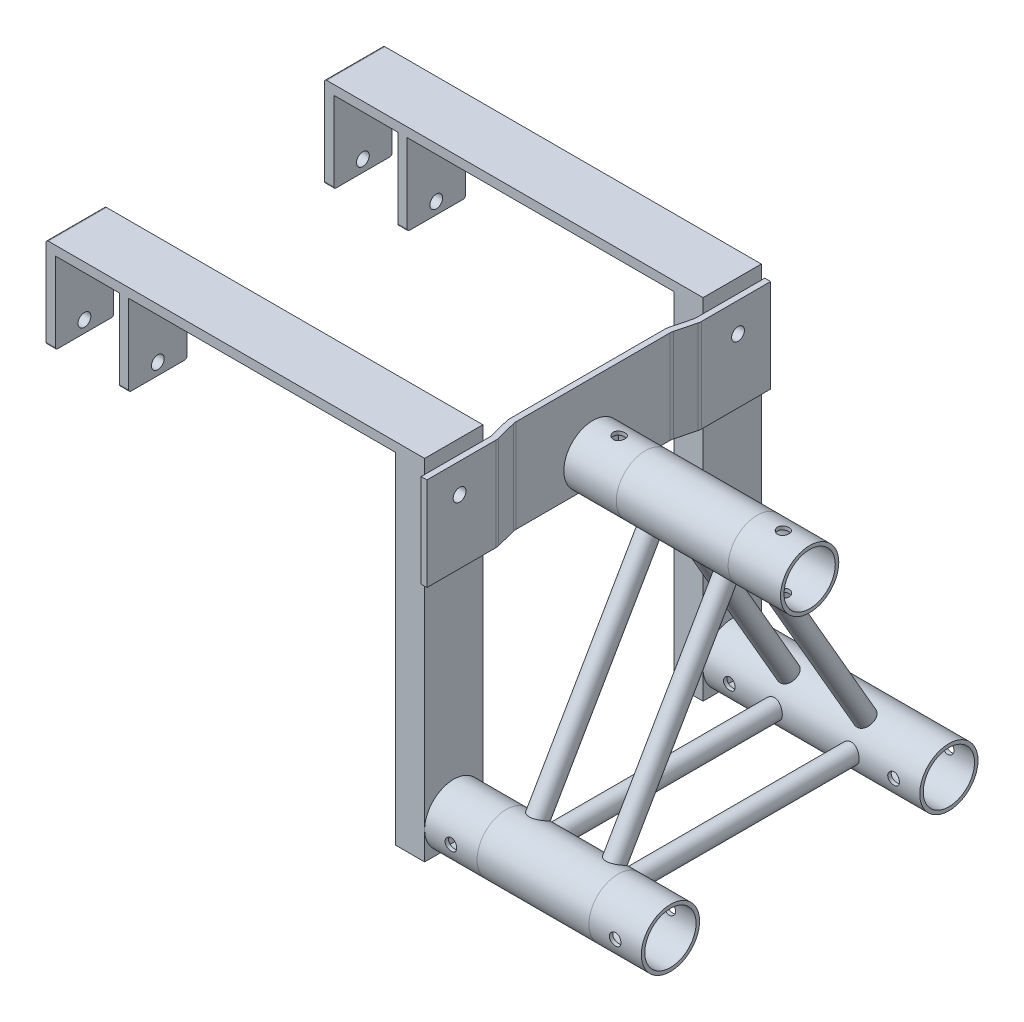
SolidWorks part; units mm, degrees
ref_plane "Face" through (0, 0, 0) normal (0, 0, 1) x (1, 0, 0)
ref_plane "Dessus" through (0, 0, 0) normal (0, 1, 0) x (1, 0, 0)
ref_plane "Droite" through (0, 0, 0) normal (1, 0, 0) x (0, 0, -1)
sketch "Esquisse1" plane through (0, 0, 0) normal (0, 0, 1) x (1, 0, 0)
  line L0 (0, 0) -> (0, 78)
  line L1 (0, 78) -> (325, 78)
  line L2 (325, 78) -> (325, 70)
  line L3 (325, 70) -> (71, 70)
  line L4 (71, 70) -> (71, 0)
  line L5 (71, 0) -> (63, 0)
  line L6 (63, 0) -> (63, 70)
  line L7 (63, 70) -> (8, 70)
  line L8 (8, 70) -> (8, 0)
  line L9 (8, 0) -> (0, 0)
  dimension "D1" = 325
  dimension "D2" = 254
  dimension "D3" = 8
  dimension "D4" = 8
  dimension "D5" = 78
  dimension "D6" = 8
extrude "Extrusion1" add sketch "Esquisse1" along normal blind 50
sketch "Esquisse2" plane through (0, 70, 0) normal (0, -1, 0) x (1, 0, 0)
  line L0 (300, 50) -> (325, 50)
  line L1 (71, 50) -> (325, 50) construction
  line L2 (325, 50) -> (325, 0)
  line L3 (325, 0) -> (300, 0)
  line L4 (71, 0) -> (325, 0) construction
  line L5 (300, 0) -> (300, 5)
  line L6 (300, 5) -> (320, 5)
  line L7 (320, 5) -> (320, 45)
  line L8 (320, 45) -> (300, 45)
  line L9 (300, 45) -> (300, 50)
  dimension "D1" = 25
  dimension "D2" = 5
  dimension "D3" = 5
extrude "Extrusion2" add sketch "Esquisse2" along normal blind 292
sketch "Esquisse3" plane through (325, 0, 0) normal (1, 0, 0) x (0, 0, -1)
  line L0 (0, -222) -> (0, 78) construction
  line L1 (0, -222) -> (-50, -222) construction
  circle A0 centre (-25, 41) radius 5.5
  circle A1 centre (-25, -198) radius 5.5
  dimension "D1" = 11
  dimension "D2" = 25
  dimension "D3" = 239
  dimension "D4" = 24
extrude "Enlèv. mat.-Extru.1" cut sketch "Esquisse3" against normal up to next
sketch "Esquisse4" plane through (71, 0, 0) normal (1, 0, 0) x (0, 0, -1)
  line L0 (0, -222) -> (0, 78) construction
  line L1 (-50, 0) -> (0, 0) construction
  circle A0 centre (-25, 10) radius 5.5
  dimension "D2" = 11
  dimension "D1" = 25
  dimension "D3" = 10
extrude "Enlèv. mat.-Extru.2" cut sketch "Esquisse4" against normal through all
fillet "Congé1" radius 2
pattern_linear "Répétition linéaire1" count 2 spacing 239
ref_plane "Plan1" through (0, 66, 0) normal (0, 1, 0) x (-1, 0, 0)
sketch "Esquisse5" plane through (0, 66, 0) normal (0, 1, 0) x (-1, 0, 0)
  line L0 (-325, 292) -> (-330, 292)
  line L1 (-330, 292) -> (-330, 231.3649)
  line L2 (-330, 231.3649) -> (-325, 212)
  line L3 (-325, 212) -> (-325, 77)
  line L4 (-325, 77) -> (-330, 57.6351)
  line L5 (-330, 57.6351) -> (-330, -3)
  line L6 (-330, -3) -> (-325, -3)
  line L7 (-325, -3) -> (-325, 57)
  line L8 (-325, 57) -> (-320, 76.3649)
  line L9 (-320, 76.3649) -> (-320, 212.6351)
  line L10 (-320, 212.6351) -> (-325, 232)
  line L11 (-325, 232) -> (-325, 292)
  line L12 (-325, 289) -> (-325, 239) construction
  line L14 (-325, 289) -> (-2, 289) construction
  dimension "D1" = 5
  dimension "D2" = 5
  dimension "D3" = 3
  dimension "D4" = 295
  dimension "D5" = 135
  dimension "D6" = 175
  dimension "D7" = 60
  dimension "D8" = 80
  dimension "D9" = 20
  dimension "D10" = 20
extrude "Extrusion3" add sketch "Esquisse5" against normal blind 80
sketch "Esquisse6" plane through (330, 0, 0) normal (1, 0, 0) x (0, 0, -1)
  circle A0 centre (-264, 41) radius 5.5 construction
  circle A1 centre (-25, 41) radius 5.5 construction
  circle A2 centre (-264, 41) radius 5.5
  circle A3 centre (-25, 41) radius 5.5
extrude "Enlèv. mat.-Extru.3" cut sketch "Esquisse6" against normal blind 5
sketch "Esquisse7" plane through (325, 0, 0) normal (1, 0, 0) x (0, 0, -1)
  line L0 (3, -14) -> (3, 66) construction
  circle A0 centre (-144.5, 9) radius 5.5
  circle A1 centre (-25, 41) radius 5.5 construction
  dimension "D2" = 147.5
  dimension "D1" = 32
extrude "Enlèv. mat.-Extru.4" cut sketch "Esquisse7" against normal blind 5
sketch "Esquisse8" plane through (325, 0, 0) normal (1, 0, 0) x (0, 0, -1)
  circle A0 centre (-144.5, 9) radius 25
  circle A1 centre (-25, -198) radius 25
  circle A2 centre (-264, -198) radius 25
  circle A3 centre (-144.5, 9) radius 5.5 construction
  circle A4 centre (-264, -198) radius 5.5 construction
  circle A5 centre (-25, -198) radius 5.5 construction
  dimension "D1" = 50
extrude "Extru.-Mince3" add sketch "Esquisse8" along normal blind 186 thin
sketch "Esquisse9" plane through (0, 0, 0) normal (0, 0, 1) x (1, 0, 0)
  line L0 (370, 91.5662) -> (370, -251.9659)
  line L1 (370, -251.9659) -> (466, -251.9659)
  line L2 (466, -251.9659) -> (466, 91.5662)
  line L3 (466, 91.5662) -> (370, 91.5662)
  line L4 (325, -198) -> (325, -14) construction
  line L5 (511, -16) -> (511, 34) construction
  dimension "D1" = 45
  dimension "D2" = 45
ref_plane "Plan2" through (0, 64.8203, 112.2721) normal (0, -0.5, -0.866) x (-1, 0, 0)
ref_plane "Plan4" through (385, 0, 0) normal (1, 0, 0) x (0, 0, -1)
sketch "Esquisse12" plane through (385, 0, 0) normal (1, 0, 0) x (0, 0, -1)
  line L0 (-144.5, 9) -> (-25, -198)
  line L1 (-177.224, -47.6797) -> (-47.3202, 177.3203) construction
  line L2 (-25, -198) -> (-264, -198)
  line L3 (-264, -198) -> (-144.5, 9)
ref_plane "Plan5" through (385, 9, 144.5) normal (0, -0.866, -0.5) x (1, 0, 0)
sketch "Esquisse13" plane through (385, 9, 144.5) normal (0, -0.866, -0.5) x (1, 0, 0)
  circle A0 centre (0, 0) radius 8
  dimension "D1" = 16
sweep "Balayage-Mince2" add profiles "Esquisse13" path "Esquisse12" parameters "D1"=2
pattern_linear "Répétition linéaire2" count 2 spacing 66
sketch "Esquisse14" plane through (0, 0, 289) normal (0, 0, 1) x (1, 0, 0)
  line L0 (511, -198) -> (325, -198) construction
  line L1 (325, -222) -> (325, -198) construction
  line L2 (511, -223) -> (511, -173) construction
  circle A0 centre (347.5, -198) radius 5
  circle A1 centre (488.5, -198) radius 5
  dimension "D1" = 10
  dimension "D2" = 22.5
  dimension "D3" = 22.5
extrude "Enlèv. mat.-Extru.5" cut sketch "Esquisse14" against normal through all
sketch "Esquisse15" plane through (0, 78, 0) normal (0, 1, 0) x (-1, 0, 0)
  line L0 (-466, 144.5) -> (-370, 144.5) construction
  line L1 (-488.5, 286) -> (-488.5, 289) construction
  line L2 (-347.5, 286) -> (-347.5, 289) construction
  circle A0 centre (-488.5, 144.5) radius 5
  circle A1 centre (-347.5, 144.5) radius 5
  dimension "D1" = 10
extrude "Enlèv. mat.-Extru.6" cut sketch "Esquisse15" against normal through all
fillet "Congé2" radius 10
